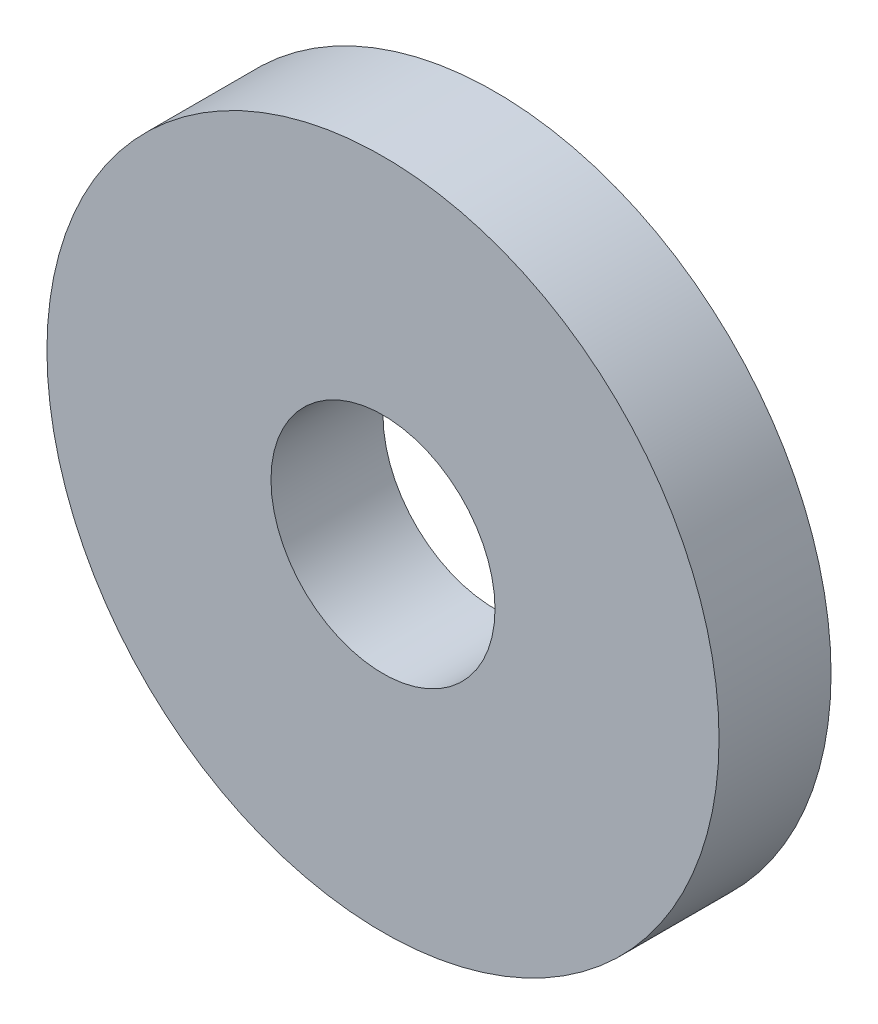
SolidWorks part; units mm, degrees
ref_plane "Front Plane" through (0, 0, 0) normal (0, 0, 1) x (1, 0, 0)
ref_plane "Top Plane" through (0, 0, 0) normal (0, 1, 0) x (1, 0, 0)
ref_plane "Right Plane" through (0, 0, 0) normal (1, 0, 0) x (0, 0, -1)
sketch "Sketch1" plane through (0, 0, 0) normal (0, 0, 1) x (1, 0, 0)
  circle A0 centre (-51.2845, 26.4394) radius 9.525
  circle A1 centre (-51.2845, 26.4394) radius 3.175
  dimension "D1" = 19.05
  dimension "D2" = 6.35
extrude "Boss-Extrude1" add sketch "Sketch1" along normal blind 3.175
